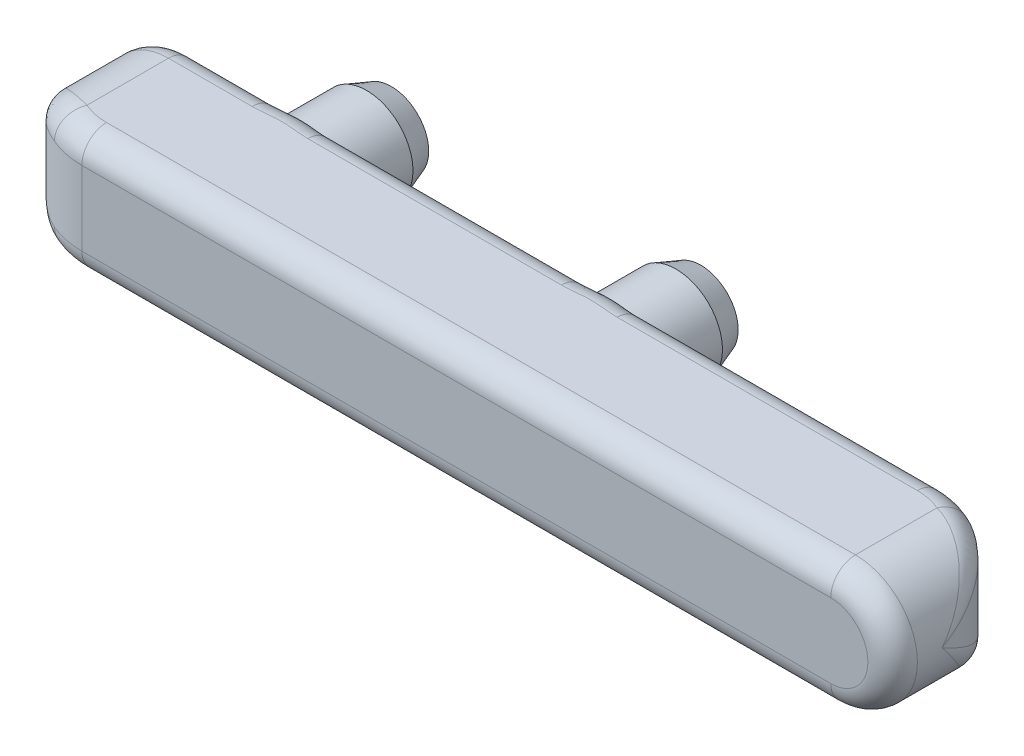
SolidWorks part; units mm, degrees
ref_plane "Plan de face" through (0, 0, 0) normal (0, 0, 1) x (1, 0, 0)
ref_plane "Plan de dessus" through (0, 0, 0) normal (0, 1, 0) x (1, 0, 0)
ref_plane "Plan de droite" through (0, 0, 0) normal (1, 0, 0) x (0, 0, -1)
sketch "Esquisse1" plane through (0, 0, 0) normal (0, 0, 1) x (1, 0, 0)
  line L0 (0, 0) -> (31.25, 0) construction
  line L1 (0, 2.5) -> (31.25, 2.5)
  line L2 (0, -2.5) -> (31.25, -2.5)
  arc A0 (0, 2.5) -> (0, -2.5) centre (0, 0) ccw
  arc A1 (31.25, -2.5) -> (31.25, 2.5) centre (31.25, 0) ccw
  point P3 (15.625, 0)
  dimension "D1" = 2.5
  dimension "D2" = 31.25
extrude "Boss.-Extru.1" add sketch "Esquisse1" along normal blind 5.5
sketch "Esquisse3" plane through (0, 0, 0) normal (0, 0, -1) x (-1, 0, 0)
  line L0 (-31.25, 0) -> (0, 0) construction
  circle A0 centre (-17, 0) radius 1.875
  circle A1 centre (-4.5, 0) radius 1.875
  arc A3 (0, -2.5) -> (0, 2.5) centre (0, 0) ccw construction
  dimension "D1" = 3.75
  dimension "D2" = 4.5
  dimension "D3" = 12.5
extrude "Boss.-Extru.3" add sketch "Esquisse3" along normal blind 3.5
sketch "Esquisse4" plane through (0, -2.5, 0) normal (0, -1, 0) x (1, 0, 0)
  line L2 (33.75, 0) -> (33.75, 5.5) construction
  line L3 (-2.5, 5.5) -> (-2.5, 0) construction
  line L4 (-2.5, 5.5) -> (-2.5, 2)
  line L7 (1, 5.5) -> (-2.5, 5.5)
  line L8 (30.25, 0) -> (33.75, 0)
  line L9 (33.75, 0) -> (33.75, 3.5)
  line L10 (0, 0) -> (31.25, 0) construction
  line L11 (0, 5.5) -> (31.25, 5.5) construction
  arc A0 (1, 5.5) -> (-2.5, 2) centre (1, 2) ccw
  arc A1 (30.25, 0) -> (33.75, 3.5) centre (30.25, 3.5) ccw
  dimension "D1" = 3.5
  dimension "D2" = 3.5
extrude "Enlèv. mat.-Extru.1" cut sketch "Esquisse4" against normal through all
ref_plane "Plan1" through (-2.5, 0, 0) normal (-1, 0, 0) x (0, 0, 1)
ref_plane "Plan2" through (33.75, 0, 0) normal (1, 0, 0) x (0, 0, -1)
chamfer "Chanfrein2" distance 1 angle 20 2 edges at (15.125, 0, -3.5) (2.625, 0, -3.5)
fillet "Congé1" radius 1 14 edges at (32.6414, 2.077, 0.9444) (30.7553, 2.5, 0.0367) (15.125, 2.5, 0) (-2.5, 0, 0) (32.6414, -2.077, 0.9444) (30.7553, -2.5, 0.0367) (-1.3914, -2.077, 4.5556) (0.4947, -2.5, 5.4633) (-1.3914, 2.077, 4.5556) (0.4947, 2.5, 5.4633) (16.125, 2.5, 5.5) (33.75, 0, 5.5) (15.125, -2.5, 0) (16.125, -2.5, 5.5)
